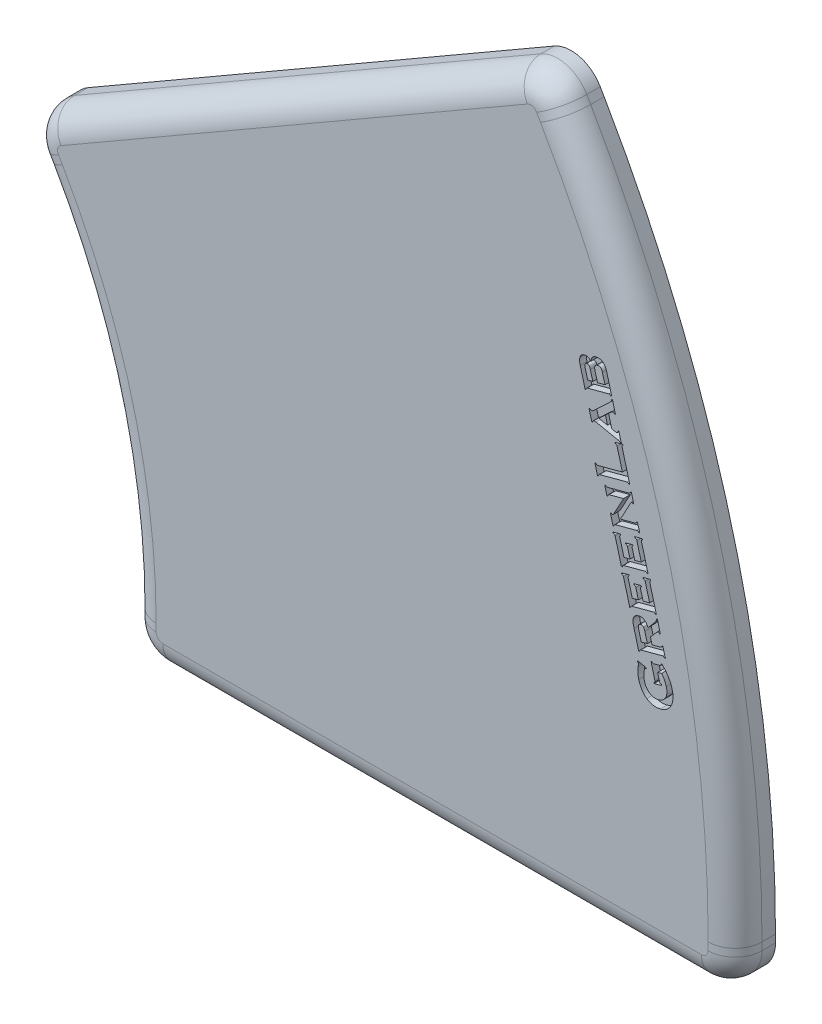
SolidWorks part; units mm, degrees
ref_plane "Front Plane" through (0, 0, 0) normal (0, 0, 1) x (1, 0, 0)
ref_plane "Top Plane" through (0, 0, 0) normal (0, 1, 0) x (1, 0, 0)
ref_plane "Right Plane" through (0, 0, 0) normal (1, 0, 0) x (0, 0, -1)
ref_plane "Plane1" through (0, 0, 3) normal (0, 0, 1) x (1, 0, 0)
sketch "Sketch1" plane through (0, 0, 3) normal (0, 0, 1) x (1, 0, 0)
  line L0 (22.5, 6.0291) -> (8.2356, 30.7356)
  line L1 (8.2356, 30.7356) -> (-30.7356, 8.2356)
  line L2 (-30.7356, 8.2356) -> (-22.5, -6.0289)
  line L3 (-22.5, -6.0289) -> (-22.5, -22.5)
  line L4 (-22.5, -22.5) -> (22.5, -22.5)
  line L5 (22.5, -22.5) -> (22.5, 6.0291)
  dimension "D1" = 14.2644
  dimension "D2" = 45
  dimension "D3" = 53.2356
  dimension "D4" = 16.4711
  dimension "D5" = 28.5291
  dimension "D6" = 30.7356
  dimension "D7" = 53.2356
extrude "Boss-Extrude1" add sketch "Sketch1" against normal blind 3
fillet "Fillet1" radius 2.5 4 edges at (-22.5, -22.5, 1.5) (22.5, -22.5, 1.5) (-30.7356, 8.2356, 1.5) (8.2356, 30.7356, 1.5)
fillet "Fillet2" radius 50 1 edges at (-22.5, -6.0289, 1.5)
fillet "Fillet3" radius 95 1 edges at (22.5, 6.0291, 1.5)
fillet "Fillet4" radius 2 12 edges at (19.2629, 5.1617, 3) (22.5, -19.7132, 3) (9.6289, 28.3223, 3) (21.7678, -21.7678, 3) (7.9675, 29.7353, 3) (0, -22.5, 3) (-11.25, 19.4856, 3) (-21.7678, -21.7678, 3) (-29.7353, 7.9676, 3) (-22.5, -19.7132, 3) (-29.3421, 5.822, 3) (-24.2037, -6.4854, 3)
sketch "Sketch2" plane through (0, 0, 3) normal (0, 0, 1) x (1, 0, 0)
  line L0 (20, -20.5) -> (7.0705, 27.7535) construction
  line L1 (13.5352, 3.6268) -> (-48282.7551, -12937.329) construction
  line L2 (9.6253, 25.9464) -> (21.3089, -17.6576) construction
  text T0 "GreenLab" font "Copperplate Gothic Bold" height 2.5
  point P6 (13.5352, 3.6268)
  point P10 (15.4671, 4.1444)
  dimension "D1" = 2
extrude "Cut-Extrude1" cut sketch "Sketch2" against normal blind 0.5
